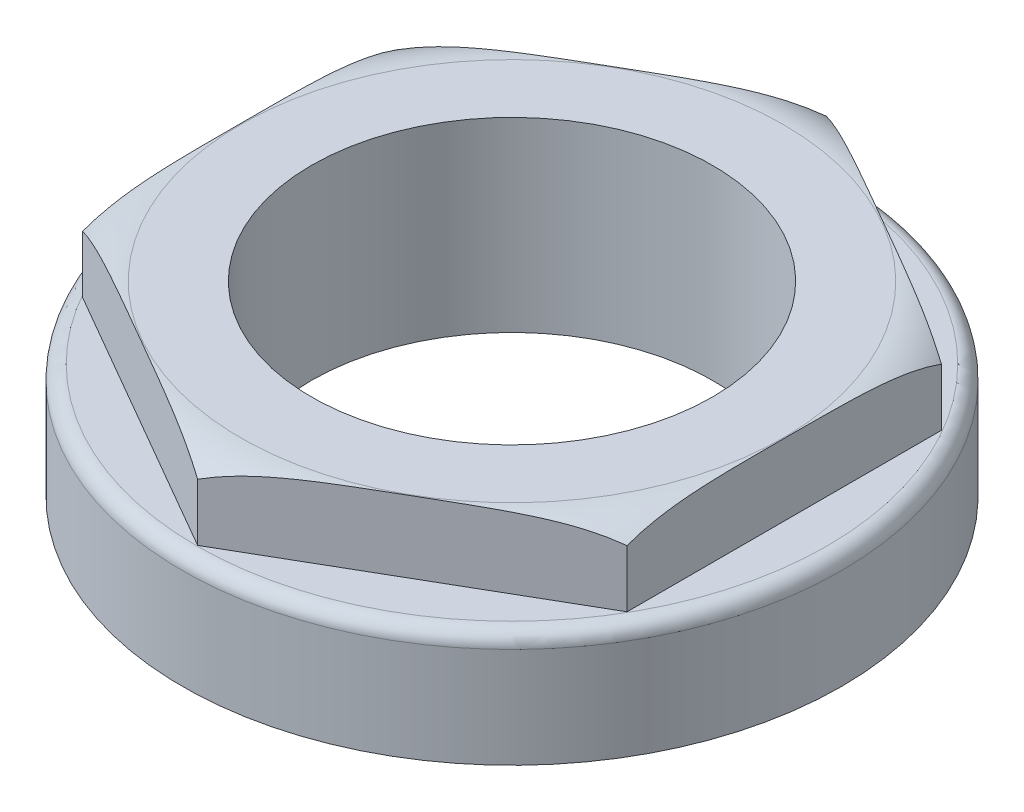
SolidWorks part; units mm, degrees
ref_plane "Alzado" through (0, 0, 0) normal (0, 0, 1) x (1, 0, 0)
ref_plane "Planta" through (0, 0, 0) normal (0, 1, 0) x (1, 0, 0)
ref_plane "Vista lateral" through (0, 0, 0) normal (1, 0, 0) x (0, 0, -1)
sketch "Croquis1" plane through (0, 0, 0) normal (0, 0, 1) x (1, 0, 0)
  line L0 (23, 0) -> (23, 2)
  line L1 (23, 2) -> (19, 2)
  line L2 (19, 2) -> (19, 7)
  line L3 (19, 7) -> (18, 7)
  line L4 (18, 7) -> (18, 0)
  line L5 (18, 0) -> (23, 0)
  line L6 (18, 0) -> (0, 0) construction
  line L7 (0, 0) -> (0, 7) construction
  line L8 (0, 7) -> (18, 7) construction
  dimension "D1" = 18
  dimension "D2" = 5
  dimension "D5" = 7
  dimension "D6" = 2
  dimension "D7" = 1
revolve "Revolución1" add sketch "Croquis1" angle 360 about L7
sketch "Croquis2" plane through (0, 0, 0) normal (0, -1, 0) x (1, 0, 0)
  circle A0 centre (0, 0) radius 23
  circle A1 centre (0, 0) radius 21.5
  circle A2 centre (0, 0) radius 23 construction
  dimension "D1" = 1.5
extrude "Saliente-Extruir1" add sketch "Croquis2" along normal blind 6
sketch "Croquis3" plane through (0, 0, 0) normal (0, -1, 0) x (1, 0, 0)
  circle A0 centre (0, 0) radius 14
  circle A1 centre (0, 0) radius 17
  dimension "D1" = 28
  dimension "D2" = 34
extrude "Saliente-Extruir2" add sketch "Croquis3" along normal blind 6 and the other way blind 7
sketch "Croquis4" plane through (0, 2, 0) normal (0, 1, 0) x (1, 0, 0)
  line L0 (0, 21.9393) -> (0, 0) construction
  line L1 (0, 21.9393) -> (-19, 10.9697)
  line L2 (-19, 10.9697) -> (-19, -10.9697)
  line L3 (-19, -10.9697) -> (0, -21.9393)
  line L4 (0, -21.9393) -> (19, -10.9697)
  line L5 (19, -10.9697) -> (19, 10.9697)
  line L6 (19, 10.9697) -> (0, 21.9393)
  circle A0 centre (0, 0) radius 19 construction
  circle A1 centre (0, 0) radius 19 construction
  circle A2 centre (0, 0) radius 14
  dimension "D1" = 28
extrude "Saliente-Extruir3" add sketch "Croquis4" along normal blind 5 and the other way up to surface
sketch "Croquis5" plane through (0, 0, 0) normal (1, 0, 0) x (0, 0, -1)
  line L0 (-21.9393, 7) -> (-18.9393, 7)
  line L1 (-21.9393, 7) -> (-10.9697, 7) construction
  line L2 (-21.9393, 7) -> (-21.9393, 2) construction
  line L3 (-21.9393, 7) -> (-21.9393, 6)
  line L4 (0, 0) -> (0, 7) construction
  line L5 (-10.9697, 7) -> (10.9697, 7) construction
  arc A0 (-18.9393, 7) -> (-21.9393, 6) centre (-18.9393, 2) ccw
  dimension "D1" = 1
  dimension "D2" = 3
revolve "Cortar-Revolución1" cut sketch "Croquis5" angle 360 about L4
fillet "Redondeo1" radius 1 1 edges at (23, 2, 0)
